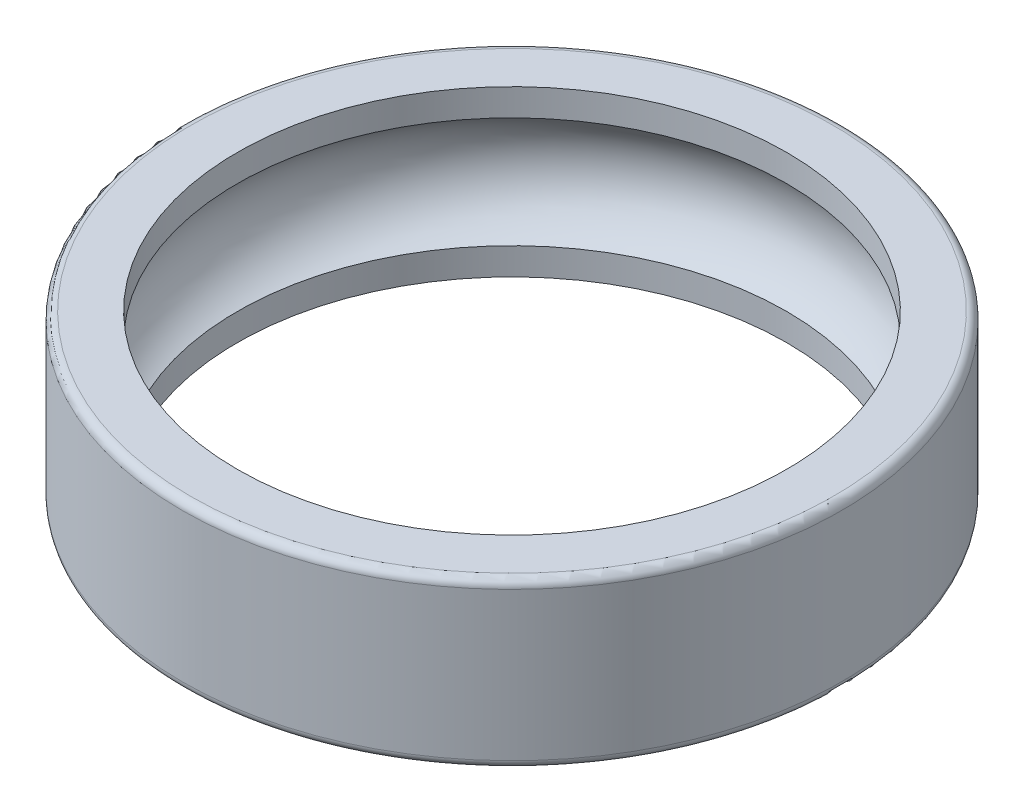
SolidWorks part; units mm, degrees
ref_plane "Plan de face" through (0, 0, 0) normal (0, 0, 1) x (1, 0, 0)
ref_plane "Plan de dessus" through (0, 0, 0) normal (0, 1, 0) x (1, 0, 0)
ref_plane "Plan de droite" through (0, 0, 0) normal (1, 0, 0) x (0, 0, -1)
ref_plane "Plan1" through (0, 0, 0) normal (0, 0, -1) x (-1, 0, 0)
sketch "Esquisse1" plane through (0, 0, 0) normal (0, 0, -1) x (-1, 0, 0)
  line L0 (-10, -3) -> (-10, -2.0156)
  line L1 (-10, 2.0156) -> (-10, 3)
  line L2 (-10, 3) -> (-12, 3)
  line L3 (-12, 3) -> (-12, -3)
  line L4 (-12, -3) -> (-10, -3)
  line L5 (0, -3) -> (0, 3) construction
  arc A0 (-10, -2.0156) -> (-10, 2.0156) centre (-9, 0) cw
revolve "Révolution1" add sketch "Esquisse1" angle 360 about L5
fillet "Congé1" radius 0.3 2 edges at (0, 3, 12) (0, -3, 12)
